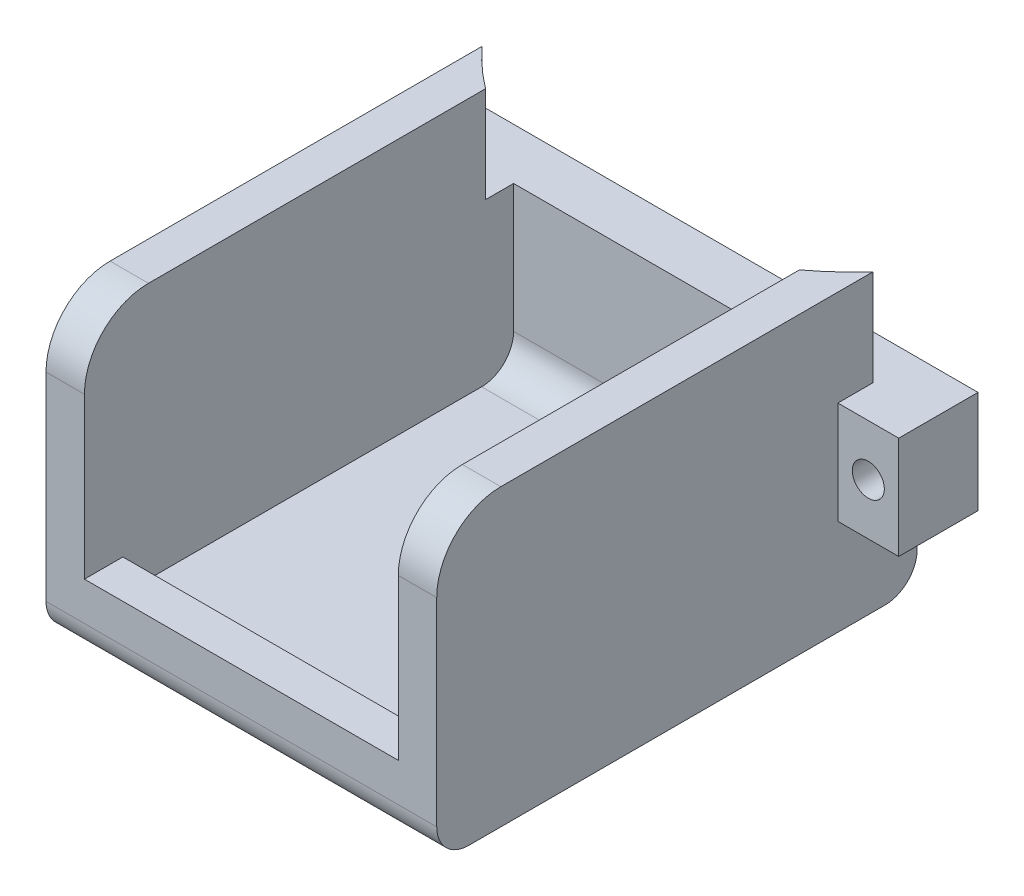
SolidWorks part; units mm, degrees
ref_plane "Front Plane" through (0, 0, 0) normal (0, 0, 1) x (1, 0, 0)
ref_plane "Top Plane" through (0, 0, 0) normal (0, 1, 0) x (1, 0, 0)
ref_plane "Right Plane" through (0, 0, 0) normal (1, 0, 0) x (0, 0, -1)
sketch "Sketch1" plane through (0, 0, 0) normal (0, 1, 0) x (1, 0, 0)
  circle A3 centre (0, 0) radius 40
extrude "Boss-Extrude1" add sketch "Sketch1" along normal blind 16
sketch "Sketch2" plane through (0, 16, 0) normal (0, 1, 0) x (1, 0, 0)
  line L1 (20.5, -20.5) -> (-20.5, -20.5)
  line L2 (20.5, -20.5) -> (20.5, 20.5)
  line L3 (20.5, 20.5) -> (-20.5, 20.5)
  line L4 (-20.5, -20.5) -> (-20.5, 20.5)
  point P4 (0, 0)
  dimension "D1" = 41
  dimension "D2" = 20.5
  dimension "D3" = 20.5
extrude "Cut-Extrude1" cut sketch "Sketch2" against normal through all
ref_plane "Plane1" through (0, 0, 0) normal (-1, 0, 0) x (0, 0, 1)
sketch "Sketch13" plane through (0, 0, 20.5) normal (0, 0, -1) x (-1, 0, 0)
  line L1 (-30.5, 31) -> (30.5, 31)
  line L2 (-30.5, 31) -> (-30.5, -15)
  line L3 (-30.5, -15) -> (30.5, -15)
  line L4 (30.5, 31) -> (30.5, -15)
  line L6 (20.5, 0) -> (20.5, 16) construction
  line L7 (-20.5, 0) -> (-20.5, 16) construction
  line L8 (20.5, 0) -> (-20.5, 0) construction
  line L9 (20.5, 16) -> (-20.5, 16) construction
  dimension "D1" = 10
  dimension "D2" = 10
  dimension "D3" = 15
  dimension "D4" = 15
extrude "Boss-Extrude4" add sketch "Sketch13" against normal blind 75
sketch "Sketch14" plane through (0, 31, 0) normal (0, 1, 0) x (1, 0, 0)
  line L0 (-30.5, -95.5) -> (30.5, -95.5) construction
  line L1 (24.5, -95.5) -> (-24.5, -95.5)
  line L2 (24.5, -95.5) -> (24.5, -28.5)
  line L3 (24.5, -28.5) -> (-24.5, -28.5)
  line L4 (-24.5, -95.5) -> (-24.5, -28.5)
  line L5 (30.5, -95.5) -> (30.5, -20.5) construction
  line L6 (-30.5, -95.5) -> (-30.5, -20.5) construction
  line L7 (-30.5, -20.5) -> (30.5, -20.5) construction
  dimension "D1" = 6
  dimension "D2" = 6
  dimension "D3" = 8
extrude "Cut-Extrude2" cut sketch "Sketch14" against normal blind 35
sketch "Sketch15" plane through (0, -4, 0) normal (0, 1, 0) x (1, 0, 0)
  line L0 (24.5, -95.5) -> (24.5, -28.5) construction
  line L1 (-24.5, -28.5) -> (24.5, -28.5)
  line L2 (-24.5, -28.5) -> (-24.5, -89.5)
  line L3 (-24.5, -89.5) -> (24.5, -89.5)
  line L4 (24.5, -28.5) -> (24.5, -89.5)
  line L5 (-24.5, -95.5) -> (24.5, -95.5) construction
  dimension "D1" = 6
extrude "Cut-Extrude3" cut sketch "Sketch15" against normal blind 5
fillet "Fillet1" radius 10 2 edges at (27.5, 31, 95.5) (-27.5, 31, 95.5)
fillet "Fillet2" radius 5 4 edges at (0, -9, 89.5) (0, -15, 95.5) (0, -15, 20.5) (0, -9, 28.5)
sketch "Sketch17" plane through (0, 16, 0) normal (0, 1, 0) x (1, 0, 0)
  circle A0 centre (0, 0) radius 41
  dimension "D1" = 82
extrude "Cut-Extrude5" cut sketch "Sketch17" along normal up to next
sketch "Sketch18" plane through (0, 16, 0) normal (0, 1, 0) x (1, 0, 0)
  line L0 (-20.5, 20.5) -> (-20.5, -20.5) construction
  line L1 (20.5, -20.5) -> (20.5, 20.5) construction
  line L2 (-20.5, -20.5) -> (20.5, -20.5) construction
  line L3 (-20.5, 20.5) -> (-20.5, -20.5) construction
  line L4 (20.5, -20.5) -> (20.5, 20.5) construction
  line L5 (-20.5, -20.5) -> (20.5, -20.5) construction
  line L6 (40, 0) -> (20.5, 0) construction
  line L8 (20.5, 0) -> (20.5, -20.5)
  line L9 (20.5, -20.5) -> (-20.5, -20.5)
  line L10 (-20.5, 0) -> (-20.5, -20.5)
  line L11 (40, 0) -> (20.5, 0)
  line L12 (40, 0) -> (40, -32.8748)
  line L13 (40, -32.8748) -> (24.5, -32.8748)
  line L14 (-40, 0) -> (-40, -32.8748)
  line L15 (24.5, -32.8748) -> (24.5, -28.5) construction
  line L16 (24.5, -28.5) -> (-24.5, -28.5) construction
  line L17 (-24.5, -28.5) -> (-24.5, -32.8748) construction
  line L18 (-24.5, -28.5) -> (-24.5, -32.8748)
  line L19 (24.5, -28.5) -> (-24.5, -28.5)
  line L20 (24.5, -32.8748) -> (24.5, -28.5)
  line L21 (-20.5, 0) -> (-40, 0)
  line L22 (-20.5, 0) -> (-40, 0) construction
  line L23 (-24.5, -32.8748) -> (-40, -32.8748)
  arc A0 (30.5, -25.8795) -> (-30.5, -25.8795) centre (0, 0) ccw construction
extrude "Boss-Extrude5" add sketch "Sketch18" against normal up to surface (16 mm away)
sketch "Sketch16" plane through (20.5, 0, 0) normal (-1, 0, 0) x (0, 0, 1)
  line L0 (20.5, 16) -> (-20.5, 16) construction
  line L2 (-20.5, 0) -> (-20.5, 16) construction
  circle A0 centre (0, 8) radius 3
  dimension "D1" = 6
  dimension "D2" = 8
  dimension "D3" = 20.5
extrude "Cut-Extrude4" cut sketch "Sketch16" against normal through all and the other way through all
sketch "Sketch19" plane through (0, 0, 32.8748) normal (0, 0, 1) x (1, 0, 0)
  line L0 (-40, 0) -> (-40, 16) construction
  line L1 (-40, 16) -> (-30.5, 16) construction
  line L2 (30.5, 16) -> (40, 16) construction
  line L3 (40, 0) -> (40, 16) construction
  point P0 (-35.25, 8)
  point P1 (35.25, 8)
  dimension "D1" = 4.75
  dimension "D2" = 8
  dimension "D3" = 8
  dimension "D4" = 4.75
hole_wizard "Ø5.0mm Dowel Hole1" positions "3DSketch1" profile "Sketch20" hole size "Ø5.0" standard "ANSI Metric"
sketch3d "3DSketch1"
  point P0 (-35.25, 8, 32.8748)
  point P3 (35.25, 8, 32.8748)
sketch "Sketch20" plane through (-35.25, 8, 32.8748) normal (1, 0, 0) x (0, -1, 0)
  line L0 (0, 0) -> (0, 26.5022)
  line L1 (0, 26.5022) -> (2.5, 25)
  line L2 (2.5, 25) -> (2.5, 0)
  line L5 (2.5, 0) -> (0, 0)
  line L10 (0, 26.5022) -> (-2.5, 25) construction
  line L11 (0, -6.35) -> (0, 107.95) construction
  dimension "Hole Dia." = 5
  dimension "Hole Depth" = 25
  dimension "Drill Angle" = 118
sketch "Sketch22" plane through (0, 16, -16) normal (0, -1, 0) x (1, 0, 0)
  line L1 (-24.5, 111.5) -> (24.5, 111.5) construction
  line L3 (-40, 16) -> (-40, 48.8748) construction
  line L5 (40, 48.8748) -> (40, 16) construction
  line L7 (-20.5, 36.5) -> (20.5, 36.5) construction
  line L8 (-24.5, 111.5) -> (24.5, 111.5) construction
  line L13 (-40, 16) -> (-40, 48.8748) construction
  line L14 (40, 48.8748) -> (40, 16) construction
  line L15 (-20.5, 36.5) -> (20.5, 36.5) construction
  line L17 (40, 36.5) -> (-40, 36.5)
  line L18 (40, 36.5) -> (40, 111.5)
  line L19 (40, 111.5) -> (-40, 111.5)
  line L20 (-40, 36.5) -> (-40, 111.5)
  line L21 (40, 36.5) -> (-40, 36.5)
  line L22 (40, 36.5) -> (40, -24)
  line L23 (40, -24) -> (-40, -24)
  line L24 (-40, 36.5) -> (-40, -24)
  arc A0 (-40, 16) -> (40, 16) centre (0, 16) ccw construction
  arc A1 (-40, 16) -> (40, 16) centre (0, 16) ccw construction
  point P16 (0, -24)
extrude "Cut-Extrude7" cut sketch "Sketch22" against normal through all and the other way through all contours M41 M44 M43 M42 | L17 M37 M38 M39 M44 M41 M42 | L22 L23 M38 | L24 L23 M38
